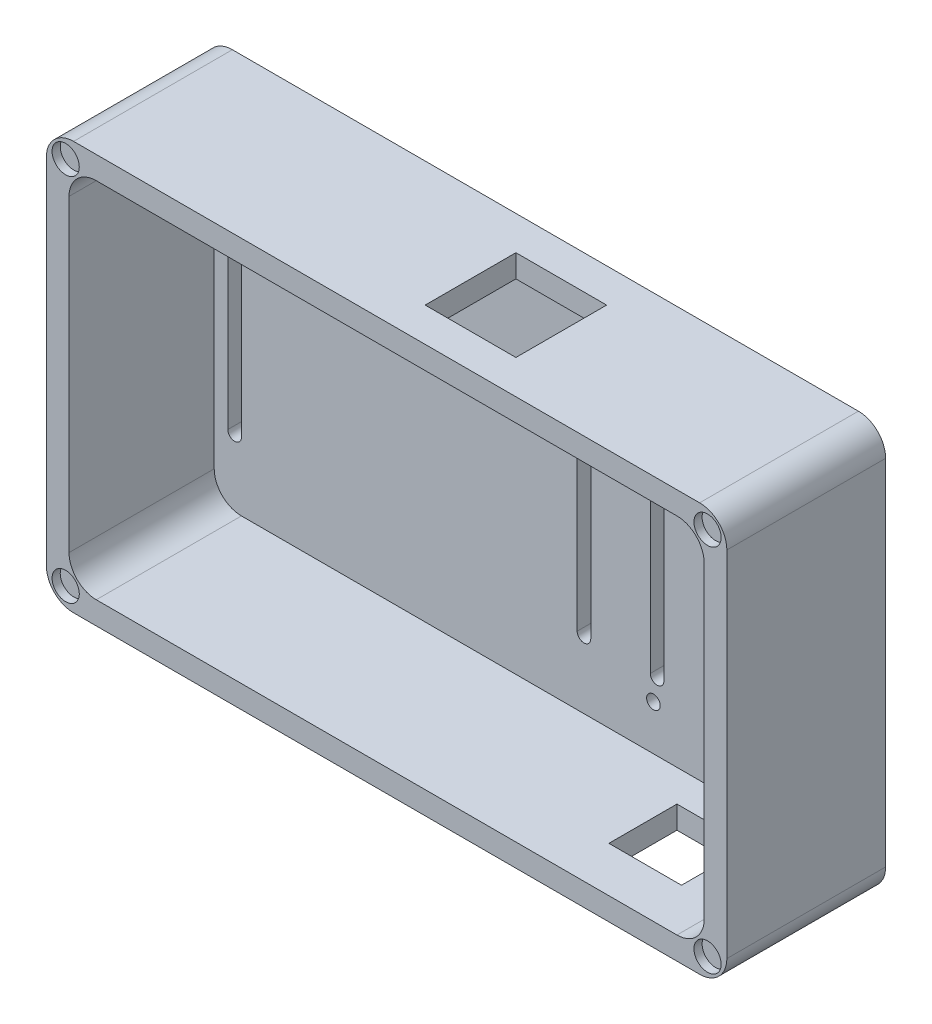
SolidWorks part; units mm, degrees
ref_plane "Plan de face" through (0, 0, 0) normal (0, 0, 1) x (1, 0, 0)
ref_plane "Plan de dessus" through (0, 0, 0) normal (0, 1, 0) x (1, 0, 0)
ref_plane "Plan de droite" through (0, 0, 0) normal (1, 0, 0) x (0, 0, -1)
sketch "Esquisse1" plane through (0, 0, 0) normal (0, 0, 1) x (1, 0, 0)
  line L5 (-69, -45) -> (69, -45)
  line L6 (-75, -39) -> (-75, 39)
  line L11 (-69, 45) -> (69, 45)
  line L12 (75, -39) -> (75, 39)
  arc A7 (-75, -39) -> (-69, -45) centre (-69, -39) ccw
  arc A8 (69, -45) -> (75, -39) centre (69, -39) ccw
  arc A9 (75, 39) -> (69, 45) centre (69, 39) ccw
  arc A10 (-69, 45) -> (-75, 39) centre (-69, 39) ccw
  point P0 (0, 0)
  point P5 (0, 0)
  point P35 (0, 0)
  point P40 (0, 0)
  dimension "D3" = 6
  dimension "D4" = 90
  dimension "D2" = 150
  dimension "D5" = 45
  dimension "D14" = 0
  dimension "D17" = 75
extrude "Boss.-Extru.2" add sketch "Esquisse1" against normal blind 35
ref_plane "Plan1" through (0, 0, 0) normal (0, 0, 1) x (1, 0, 0)
sketch "Esquisse2" plane through (0, 0, 0) normal (0, 0, 1) x (1, 0, 0)
  line L0 (-75, 39) -> (-75, -39) construction
  line L1 (64, -40) -> (-64, -40)
  line L2 (70, -34) -> (70, 34)
  line L3 (64, 40) -> (-64, 40)
  line L4 (-70, -34) -> (-70, 34)
  line L5 (75, -39) -> (75, 39) construction
  line L6 (-69, -45) -> (69, -45) construction
  line L7 (69, 45) -> (-69, 45) construction
  line L13 (-64, 34) -> (6, 34) construction
  line L14 (-64, 34) -> (-64, -36) construction
  line L15 (19.06, 36.34) -> (65.5, 36.34) construction
  line L16 (19.06, 36.34) -> (19.06, -36.5) construction
  line L17 (19.06, -36.5) -> (65.5, -36.5) construction
  line L18 (65.5, 36.34) -> (65.5, -36.5) construction
  line L19 (19.06, 36.34) -> (65.5, -36.5) construction
  line L20 (19.06, -36.5) -> (65.5, 36.34) construction
  line L21 (-64, -36) -> (6, -36) construction
  line L22 (6, 34) -> (6, -36) construction
  arc A0 (64, 40) -> (70, 34) centre (64, 34) cw
  arc A1 (70, -34) -> (64, -40) centre (64, -34) cw
  arc A2 (-64, -40) -> (-70, -34) centre (-64, -34) cw
  arc A3 (-70, 34) -> (-64, 40) centre (-64, 34) cw
  point P0 (0, 0)
  point P22 (0, 0)
  point P27 (42.28, -0.08)
  dimension "D3" = 6
  dimension "D6" = 72.84
  dimension "D7" = 5
  dimension "D8" = 5
  dimension "D9" = 4.5
  dimension "D10" = 70
  dimension "D11" = 70
  dimension "D1" = 5
  dimension "D2" = 5
  dimension "D4" = 3.5
  dimension "D5" = 46.44
extrude "Enlèv. mat.-Extru.1" cut sketch "Esquisse2" against normal blind 32
sketch "Esquisse3" plane through (0, 0, 0) normal (0, 0, 1) x (1, 0, 0)
  line L0 (-73.2426, 43.2426) -> (-68.2426, 38.2426) construction
  line L1 (0, 0) -> (0, 48.1955) construction
  line L2 (0, 0) -> (90.6816, 0) construction
  arc A0 (-69, 45) -> (-75, 39) centre (-69, 39) ccw construction
  arc A1 (-64, 40) -> (-70, 34) centre (-64, 34) ccw construction
  circle A2 centre (-70.7426, 40.7426) radius 3
  circle A3 centre (70.7426, 40.7426) radius 3
  circle A4 centre (70.7426, -40.7426) radius 3
  circle A5 centre (-70.7426, -40.7426) radius 3
  dimension "D1" = 6
extrude "Enlèv. mat.-Extru.2" cut sketch "Esquisse3" against normal blind 1.8
ref_plane "Plan2" through (0, 0, -32) normal (0, 0, 1) x (1, 0, 0)
sketch "Esquisse4" plane through (0, 0, -32) normal (0, 0, 1) x (1, 0, 0)
  line L0 (70, -34) -> (70, 34) construction
  line L1 (19.56, 36.5) -> (66, 36.5) construction
  line L2 (19.56, 36.5) -> (19.56, -36.34) construction
  line L3 (19.56, -36.34) -> (66, -36.34) construction
  line L4 (66, 36.5) -> (66, -36.34) construction
  line L5 (19.56, 36.5) -> (66, -36.34) construction
  line L6 (19.56, -36.34) -> (66, 36.5) construction
  line L7 (64, 40) -> (-64, 40) construction
  line L8 (53, 36.5) -> (53, -36.34) construction
  line L9 (42, 36.5) -> (42, -36.34) construction
  line L10 (0, 0) -> (-84.6786, 0) construction
  line L12 (-67, 25) -> (-67, -25)
  line L14 (-64, 25) -> (-64, -25)
  line L15 (0, 59.2197) -> (0, -51.8099) construction
  line L19 (64, 25) -> (64, -25)
  line L20 (67, 25) -> (67, -25)
  line L21 (64, 40) -> (-64, 40) construction
  line L22 (-62, 35) -> (8, 35) construction
  line L23 (-62, 35) -> (-62, -35) construction
  line L24 (-62, -35) -> (8, -35) construction
  line L25 (8, 35) -> (8, -35) construction
  line L29 (-27, 35) -> (-27, -35) construction
  line L30 (10, 25) -> (10, -25)
  line L31 (13, 25) -> (13, -25)
  line L32 (26.12, 25) -> (26.12, -25)
  line L33 (29.12, 25) -> (29.12, -25)
  arc A0 (-67, -25) -> (-64, -25) centre (-65.5, -25) ccw
  arc A1 (-67, 25) -> (-64, 25) centre (-65.5, 25) cw
  circle A2 centre (60.72, 32.25) radius 1.5
  circle A3 centre (26.81, -30.09) radius 1.5
  arc A4 (67, 25) -> (64, 25) centre (65.5, 25) ccw
  arc A5 (67, -25) -> (64, -25) centre (65.5, -25) cw
  arc A6 (13, 25) -> (10, 25) centre (11.5, 25) ccw
  arc A7 (13, -25) -> (10, -25) centre (11.5, -25) cw
  arc A8 (26.12, -25) -> (29.12, -25) centre (27.62, -25) ccw
  arc A9 (26.12, 25) -> (29.12, 25) centre (27.62, 25) cw
  point P7 (42.78, 0.08)
  dimension "D1" = 5.28
  dimension "D6" = 3
  dimension "D8" = 3
  dimension "D16" = 70
  dimension "D2" = 46.44
  dimension "D3" = 72.84
  dimension "D4" = 4
  dimension "D5" = 4.25
  dimension "D7" = 6.25
  dimension "D9" = 7.25
  dimension "D10" = 3.5
  dimension "D11" = 13
  dimension "D12" = 24
  dimension "D13" = 50
  dimension "D14" = 3
  dimension "D15" = 64
  dimension "D17" = 70
  dimension "D18" = 5
  dimension "D19" = 2
extrude "Enlèv. mat.-Extru.3" cut sketch "Esquisse4" against normal through all and the other way through all
ref_plane "Plan3" through (0, 45, 0) normal (0, 1, 0) x (1, 0, 0)
sketch "Esquisse5" plane through (0, 45, 0) normal (0, 1, 0) x (1, 0, 0)
  line L1 (1, 27.5) -> (21, 27.5)
  line L2 (1, 27.5) -> (1, 7.5)
  line L3 (1, 7.5) -> (21, 7.5)
  line L4 (21, 27.5) -> (21, 7.5)
  line L6 (69, 0) -> (-69, 0) construction
  dimension "D1" = 20
  dimension "D2" = 7.5
  dimension "D3" = 20
  dimension "D4" = 70
extrude "Enlèv. mat.-Extru.4" cut sketch "Esquisse5" against normal blind 5
ref_plane "Plan4" through (0, -45, 0) normal (0, -1, 0) x (-1, 0, 0)
sketch "Esquisse7" plane through (0, -45, 0) normal (0, -1, 0) x (-1, 0, 0)
  line L1 (-55, 25) -> (-39, 25)
  line L2 (-55, 25) -> (-55, 10)
  line L3 (-55, 10) -> (-39, 10)
  line L4 (-39, 25) -> (-39, 10)
  line L5 (-69, 35) -> (-69, 0) construction
  line L6 (69, 0) -> (-69, 0) construction
  line L7 (69, 35) -> (-69, 35) construction
  dimension "D1" = 10
  dimension "D2" = 16
  dimension "D3" = 10
  dimension "D4" = 14
extrude "Enlèv. mat.-Extru.5" cut sketch "Esquisse7" against normal blind 10
